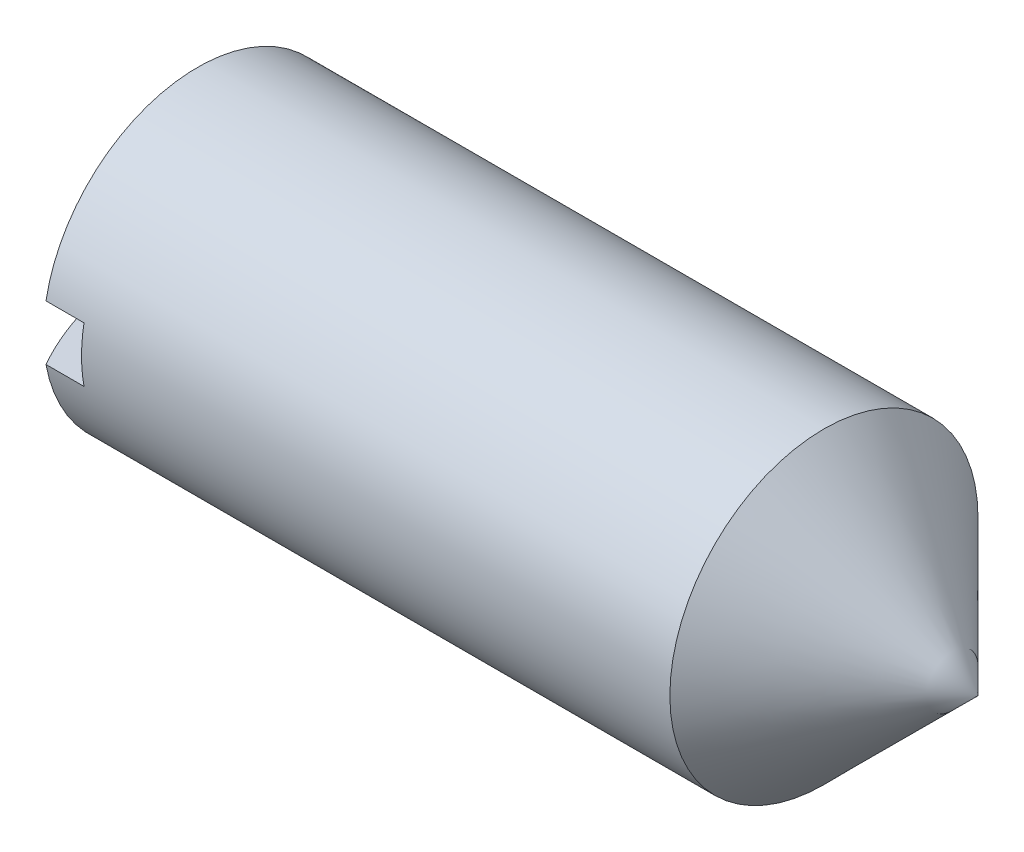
SolidWorks part; units mm, degrees
ref_plane "Plane1" through (0, 0, 0) normal (0, 0, 1) x (1, 0, 0)
ref_plane "Plane2" through (0, 0, 0) normal (0, 1, 0) x (1, 0, 0)
ref_plane "Plane3" through (0, 0, 0) normal (1, 0, 0) x (0, 0, -1)
sketch "BodySke" plane through (0, 0, 0) normal (0, 0, 1) x (1, 0, 0)
  line L0 (2.5522, -9.525) -> (15.875, -9.525) construction
  line L1 (41.275, 9.525) -> (50.8, 0)
  line L2 (2.5522, 9.525) -> (41.275, 9.525)
  line L3 (41.275, -9.525) -> (50.8, 0) construction
  line L4 (50.8, 0) -> (0, 0)
  line L5 (-12.7, 0) -> (18.4648, 0) construction
  line L6 (2.54, 12.7) -> (2.54, -6.35) construction
  arc A1 (2.5522, 9.525) -> (0, 0) centre (19.05, 0) ccw
  dimension "Crown_radius" = 19.05
  dimension "Cone_ang" = 90
  dimension "Length" = 50.8
  dimension "Diameter" = 19.05
  dimension "Advance" = 2.54
revolve "BaseBody" add sketch "BodySke"
revolve "ThreadSchematic" cut sketch "ThdSchSke"
sketch "ThdSchSke"
  line L0 (2.5522, -8.0124) -> (1.4931, -9.525)
  line L1 (2.5522, -8.0124) -> (3.6113, -9.525)
  line L2 (3.6113, -9.525) -> (3.6113, -11.9063)
  line L3 (-3.175, 0) -> (5.1513, 0) construction
  line L4 (2.5522, -9.525) -> (2.5522, -1.7018) construction
  line L5 (3.6113, -11.9063) -> (1.4931, -11.9063)
  line L6 (1.4931, -11.9063) -> (1.4931, -9.525)
extrude "Slot" cut sketch "Sketch2" along normal blind 4.9022
sketch "Sketch2" plane through (0, 0, 0) normal (1, 0, 0) x (0, 0, -1)
  line L1 (9.525, -1.7018) -> (-9.525, -1.7018)
  line L2 (9.525, -1.7018) -> (9.525, 1.7018)
  line L3 (9.525, 1.7018) -> (-9.525, 1.7018)
  line L4 (-9.525, -1.7018) -> (-9.525, 1.7018)
  dimension "D1" = 19.05
  dimension "D2" = 1.7018
  dimension "Slot_width" = 3.4036
  dimension "D3" = 9.525
pattern_linear "ThdSchPat" [suppressed]
equation "\"D1@Sketch2\" = \"Diameter@BodySke\""
equation "\"D3@Sketch2\" = \"D1@Sketch2\" / 2"
equation "\"D2@Sketch2\" = \"Slot_width@Sketch2\" / 2"
equation "\"Thread_minor@ThdSchSke\" = \"Thread_minor@ThreadCosmetic\""
equation "\"Diameter@ThdSchSke\" = \"Diameter@BodySke\""
equation "\"Overcut@ThdSchSke\" = \"Diameter@BodySke\" * 1.25"
equation "\"Num_threads@ThdSchPat\" = int( (\"Length@BodySke\" - ( \"Crown_radius@BodySke\" - sqr ( ( \"Crown_radius@BodySke\" * \"Crown_radius@BodySke\" ) - ( ( \"Diameter@BodySke\" * 0.5 ) * ( \"Diameter@BodySke\" * 0.5 ) "
equation "\"Advance@ThdSchPat\" = (\"Length@BodySke\" - ( \"Crown_radius@BodySke\" - sqr ( ( \"Crown_radius@BodySke\" * \"Crown_radius@BodySke\" ) - ( ( \"Diameter@BodySke\" * 0.5 ) * ( \"Diameter@BodySke\" * 0.5 ) ) ) ) - ("
equation "' \"Num_threads@ThdSchPat\" = \"Num_threads@ThdSchPat\" - sgn( \"Num_threads@ThdSchPat\" - 1) '---chamfered tips only---"
